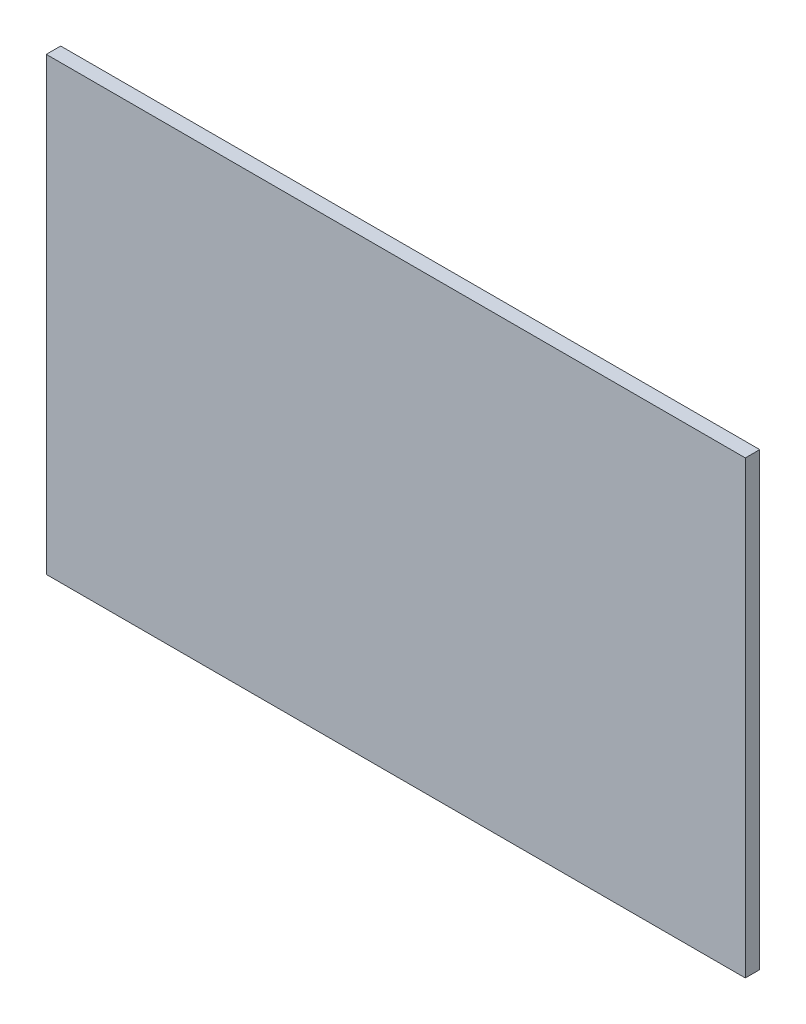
SolidWorks part; units mm, degrees
ref_plane "Front" through (0, 0, 0) normal (0, 0, 1) x (1, 0, 0)
ref_plane "Top" through (0, 0, 0) normal (0, 1, 0) x (1, 0, 0)
ref_plane "Right" through (0, 0, 0) normal (1, 0, 0) x (0, 0, -1)
sketch "Skizze1" plane through (0, 0, 0) normal (0, 0, 1) x (1, 0, 0)
  line L1 (-194, 125) -> (194, 125)
  line L2 (-194, 125) -> (-194, -125)
  line L3 (-194, -125) -> (194, -125)
  line L4 (194, 125) -> (194, -125)
  dimension "D1" = 388
  dimension "D2" = 194
  dimension "D3" = 250
  dimension "D4" = 125
extrude "Aufsatz-Linear austragen1" add sketch "Skizze1" along normal blind 8
